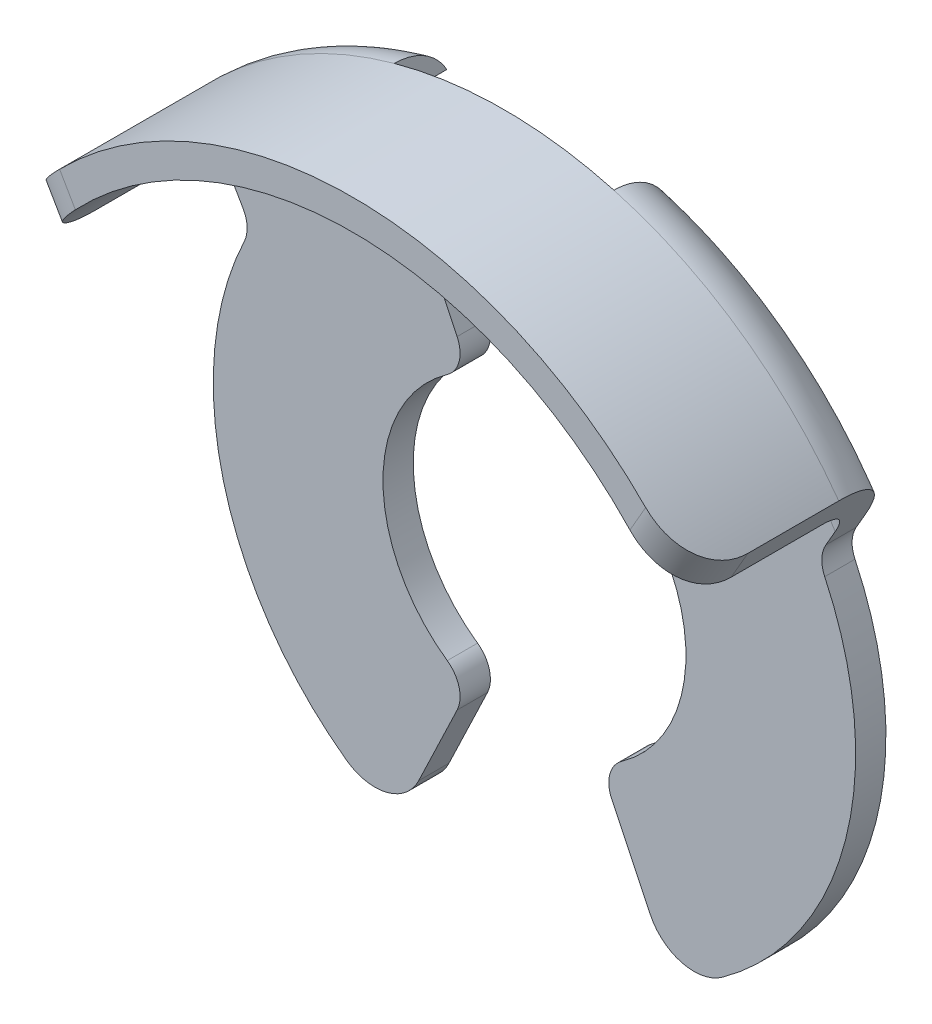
SolidWorks part; units mm, degrees
ref_plane "Front Plane" through (0, 0, 0) normal (0, 0, 1) x (1, 0, 0)
ref_plane "Top Plane" through (0, 0, 0) normal (0, 1, 0) x (1, 0, 0)
ref_plane "Right Plane" through (0, 0, 0) normal (1, 0, 0) x (0, 0, -1)
sketch "Sketch1" plane through (0, 0, 0) normal (0, 0, 1) x (1, 0, 0)
  circle A0 centre (0, 0) radius 2.5
  circle A1 centre (0, 0) radius 6.8
  dimension "D1" = 5
  dimension "D2" = 13.6
extrude "Boss-Extrude1" add sketch "Sketch1" against normal blind 3.5
sketch "Sketch2" plane through (0, 0, 0) normal (0, 0, 1) x (1, 0, 0)
  circle A0 centre (0, 0) radius 6.3
  dimension "D1" = 12.6
extrude "Cut-Extrude1" cut sketch "Sketch2" against normal blind 3
sketch "Sketch3" plane through (0, 0, 0) normal (0, 0, 1) x (1, 0, 0)
  line L0 (-5.5215, 3.969) -> (-4.6733, 2.5)
  line L1 (5.5215, 3.969) -> (4.6733, 2.5)
  circle A0 centre (0, 0) radius 6.8 construction
  arc A1 (-4.6733, 2.5) -> (4.6733, 2.5) centre (0, 0) ccw
  circle A2 centre (0, 0) radius 2.5 construction
  arc A4 (-5.5215, 3.969) -> (5.5215, 3.969) centre (0, 0) ccw
  point P7 (-5.3, 0)
  point P9 (5.3, 0)
  point P10 (0, 2.5)
  dimension "D1" = 60
  dimension "D2" = 10.6
extrude "Cut-Extrude2" cut sketch "Sketch3" against normal through all
sketch "Sketch4" plane through (0, 0, -3) normal (0, 0, 1) x (1, 0, 0)
  line L0 (0, 0) -> (-1.0784, -2.2554) construction
  line L1 (0, 0) -> (1.0784, -2.2554) construction
  line L2 (-1.0784, 2.2554) -> (-2.3473, 4.9092)
  line L3 (0, 0) -> (-1.0784, 2.2554) construction
  line L4 (0, 0) -> (1.0784, 2.2554) construction
  line L5 (2.3473, 4.9092) -> (1.0784, 2.2554)
  line L6 (1.0784, 2.2554) -> (1.0784, -2.2554) construction
  line L7 (-1.0784, 2.2554) -> (-1.0784, -2.2554) construction
  line L8 (-1.0784, -2.2554) -> (-1.9103, -3.9951)
  line L9 (1.0784, -2.2554) -> (1.9103, -3.9951)
  arc A0 (1.8621, 6.0185) -> (-1.8621, 6.0185) centre (0, 0) ccw
  arc A1 (5.2449, 3.4901) -> (-5.2449, 3.4901) centre (0, 0) ccw construction
  arc A2 (-1.0784, 2.2554) -> (-1.0784, -2.2554) centre (0, 0) ccw
  circle A3 centre (0, 0) radius 2.5 construction
  arc A4 (-2.3473, 4.9092) -> (-1.8621, 6.0185) centre (-1.6256, 5.2543) cw
  arc A6 (1.8621, 6.0185) -> (2.3473, 4.9092) centre (1.6256, 5.2543) cw
  arc A7 (-1.9103, -3.9951) -> (-3.0999, -4.2989) centre (-2.632, -3.65) cw
  arc A8 (-4.6733, 2.5) -> (4.6733, 2.5) centre (0, 0) ccw construction
  arc A9 (1.9103, -3.9951) -> (3.0999, -4.2989) centre (2.632, -3.65) ccw
  arc A10 (3.0999, -4.2989) -> (-3.0999, -4.2989) centre (0, 0) cw
  arc A11 (5.5215, 3.969) -> (-5.5215, 3.969) centre (0, 0) ccw construction
  arc A12 (1.0784, -2.2554) -> (1.0784, 2.2554) centre (0, 0) ccw
  point P1 (-2.632, -4.45)
  point P30 (2.632, -4.45)
  point P31 (0, 6.8)
  dimension "D2" = 0.8
  dimension "D1" = 11.25
extrude "Cut-Extrude3" cut sketch "Sketch4" against normal up to vertex
fillet "Fillet1" radius 1 3 edges at (0, 6.8, -3.5) (5.3832, 3.7296, 0) (-5.3832, 3.7296, 0)
fillet "Fillet2" radius 0.5 8 edges at (3.7717, 5.0462, -3) (-3.7717, 5.0462, -3) (-1.0784, -2.2554, -3.25) (1.0784, -2.2554, -3.25) (-1.0784, 2.2554, -3.25) (1.0784, 2.2554, -3.25) (-4.6733, 2.5, -3.25) (4.6733, 2.5, -3.25)
sketch "Sketch5" plane through (0, -4.5, -3.5) normal (0, 0, 1) x (1, 0, 0)
  line L0 (-1.8117, 8.2889) -> (-1.8117, 11.3)
  line L5 (1.8117, 8.2889) -> (1.8117, 11.3)
  line L6 (1.8117, 8.2889) -> (-1.8117, 8.2889)
  line L7 (1.276, 7.1687) -> (2.3473, 9.4092) construction
  line L8 (-2.3473, 9.4092) -> (-1.276, 7.1687) construction
  line L10 (-1.8117, 11.3) -> (1.8117, 11.3)
  arc A0 (5.5215, 8.469) -> (-5.5215, 8.469) centre (0, 4.5) ccw construction
extrude "Cut-Extrude5" cut sketch "Sketch5" along normal blind 1
